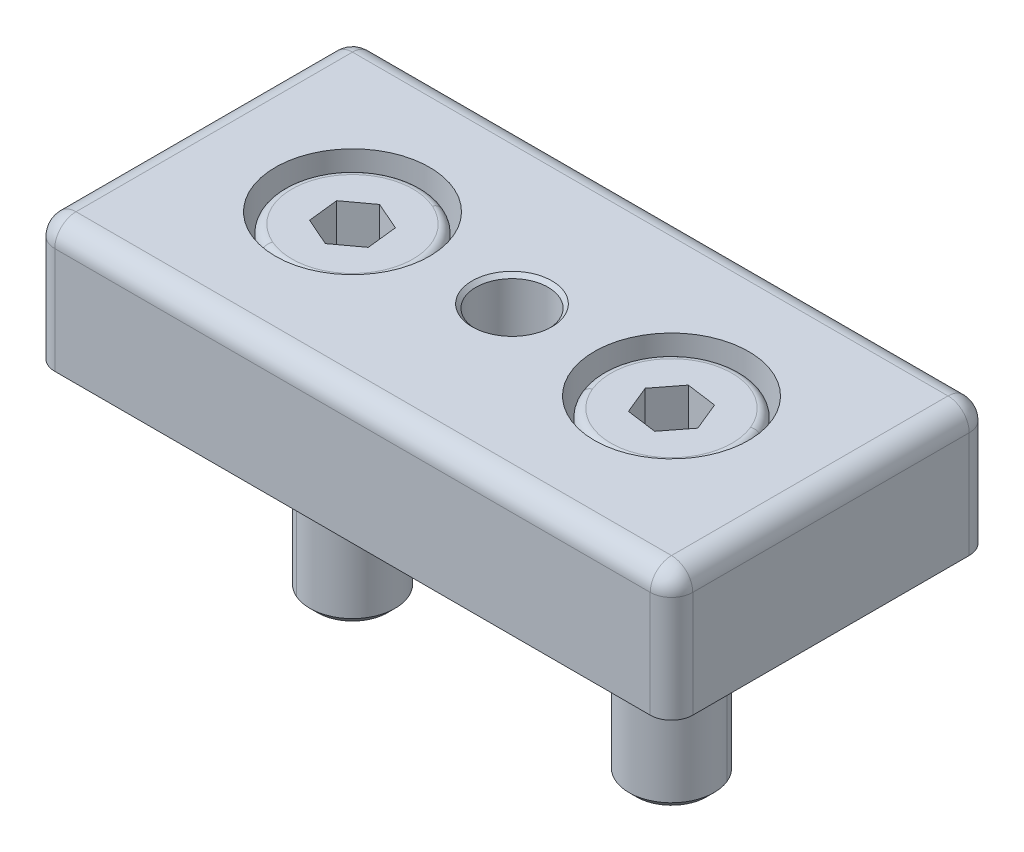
SolidWorks part; units mm, degrees
ref_plane "Front Plane" through (0, 0, 0) normal (0, 0, 1) x (1, 0, 0)
ref_plane "Top Plane" through (0, 0, 0) normal (0, 1, 0) x (1, 0, 0)
ref_plane "Right Plane" through (0, 0, 0) normal (1, 0, 0) x (0, 0, -1)
imported_body "1.5001 kierrelevy 30x60 M8-1-solid1"
imported_body "1.2087 Kuusiokoloruuvi M8x25-1-solid1"
imported_body "1.2087 Kuusiokoloruuvi M8x25-2-solid1"
sketch "Sketch1" plane through (0, -3.2572, 0) normal (0, -1, 0) x (1, 0, 0)
  line L4 (-32.1687, -15.7507) -> (23.8313, -15.7507)
  line L5 (25.8313, -13.7507) -> (25.8313, 12.2493)
  line L6 (23.8313, 14.2493) -> (-32.1687, 14.2493)
  line L7 (-34.1687, 12.2493) -> (-34.1687, -13.7507)
  line L8 (-32.1687, -15.7507) -> (23.8313, -15.7507)
  line L9 (25.8313, -13.7507) -> (25.8313, 12.2493)
  line L10 (23.8313, 14.2493) -> (-32.1687, 14.2493)
  line L11 (-34.1687, 12.2493) -> (-34.1687, -13.7507)
  circle A0 centre (-19.1687, -0.7507) radius 4.5 construction
  circle A1 centre (10.8313, -0.7507) radius 4.5 construction
  circle A2 centre (-19.1687, -0.7507) radius 4.5
  circle A3 centre (10.8313, -0.7507) radius 4.5
  arc A4 (23.8313, -15.7507) -> (25.8313, -13.7507) centre (23.8313, -13.7507) ccw
  arc A5 (25.8313, 12.2493) -> (23.8313, 14.2493) centre (23.8313, 12.2493) ccw
  arc A6 (-32.1687, 14.2493) -> (-34.1687, 12.2493) centre (-32.1687, 12.2493) ccw
  arc A7 (-34.1687, -13.7507) -> (-32.1687, -15.7507) centre (-32.1687, -13.7507) ccw
  arc A8 (23.8313, -15.7507) -> (25.8313, -13.7507) centre (23.8313, -13.7507) ccw
  arc A9 (25.8313, 12.2493) -> (23.8313, 14.2493) centre (23.8313, 12.2493) ccw
  arc A10 (-32.1687, 14.2493) -> (-34.1687, 12.2493) centre (-32.1687, 12.2493) ccw
  arc A11 (-34.1687, -13.7507) -> (-32.1687, -15.7507) centre (-32.1687, -13.7507) ccw
  dimension "D1" = 0
extrude "Cut-Extrude2" cut sketch "Sketch1" against normal blind 3.2
